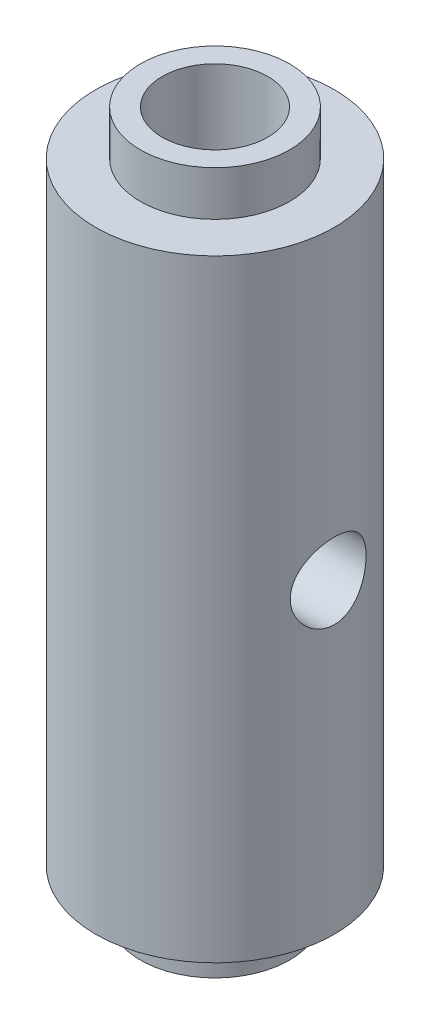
SolidWorks part; units mm, degrees
ref_plane "FRONT" through (0, 0, 0) normal (0, 0, 1) x (1, 0, 0)
ref_plane "FLOOR" through (0, 0, 0) normal (0, 1, 0) x (1, 0, 0)
ref_plane "RIGHT" through (0, 0, 0) normal (1, 0, 0) x (0, 0, -1)
sketch "PostHeight" plane through (0, 0, 0) normal (0, 0, 1) x (1, 0, 0)
  line L0 (0, 37.338) -> (-3.9687, 37.338)
  line L1 (-3.9687, 37.338) -> (-3.9687, 34.9567)
  line L2 (-3.9687, 34.9567) -> (-6.35, 34.9567)
  line L3 (-6.35, 34.9567) -> (-6.35, 2.3813)
  line L4 (-6.35, 2.3813) -> (-3.9688, 2.3813)
  line L5 (-3.9688, 2.3813) -> (-3.9688, 0)
  line L6 (-3.9688, 0) -> (0, 0)
  line L7 (0, 0) -> (0, 37.338)
  line L9 (0, 0) -> (0, 37.338) construction
  dimension "D2" = 32.5755
revolve "Height" add sketch "PostHeight" angle 360 about L9
sketch "Sketch8" plane through (0, 34.9567, 0) normal (0, 1, 0) x (-1, 0, 0)
  line L1 (6.35, 0) -> (3.1791, 0) construction
  circle A0 centre (0, 0) radius 6.35 construction
  point P0 (6.35, 0)
ref_plane "Plane7" through (-6.35, 34.9567, 0) normal (1, 0, 0) x (0, 0, -1)
sketch "Sketch9" plane through (-6.35, 34.9567, 0) normal (1, 0, 0) x (0, 0, -1)
  line L0 (0, 0) -> (0, -32.5755)
  line L1 (6.35, 0) -> (-6.35, 0) construction
  line L2 (-6.35, -32.5755) -> (6.35, -32.5755) construction
sketch "Sketch10" plane through (-6.35, 34.9567, 0) normal (1, 0, 0) x (0, 0, -1)
  line L0 (0, -16.2877) -> (0, -14.7002)
  line L1 (0, 0) -> (0, -32.5755) construction
  point P0 (0, -16.2877)
  dimension "D1" = 1.5875
ref_plane "Plane8" through (-6.35, 18.669, 0) normal (0, 1, 0) x (-1, 0, 0)
sketch "Sketch11" plane through (-6.35, 18.669, 0) normal (0, 1, 0) x (0, 0, -1)
  line L0 (-2.0193, 0) -> (-2.0193, -23.8125)
  line L1 (-2.0193, -23.8125) -> (0, -24.8862)
  line L2 (0, -24.8862) -> (0, 0)
  line L3 (0, 0) -> (-2.0193, 0)
  line L4 (0, 0) -> (0, 5.8222) construction
  dimension "D1" = 23.8125
  dimension "D2" = 2.0193
  dimension "D3" = 118
revolve "Cut-Revolve3" cut sketch "Sketch11" angle 360 about L4
other "LibFeat1"
sketch "Sketch12" plane through (0, 37.338, 0) normal (0, 1, 0) x (-1, 0, 0)
  circle A0 centre (0, 0) radius 2.8067
  dimension "D1" = 5.6134
extrude "Cut-Extrude1" cut sketch "Sketch12" against normal through all
